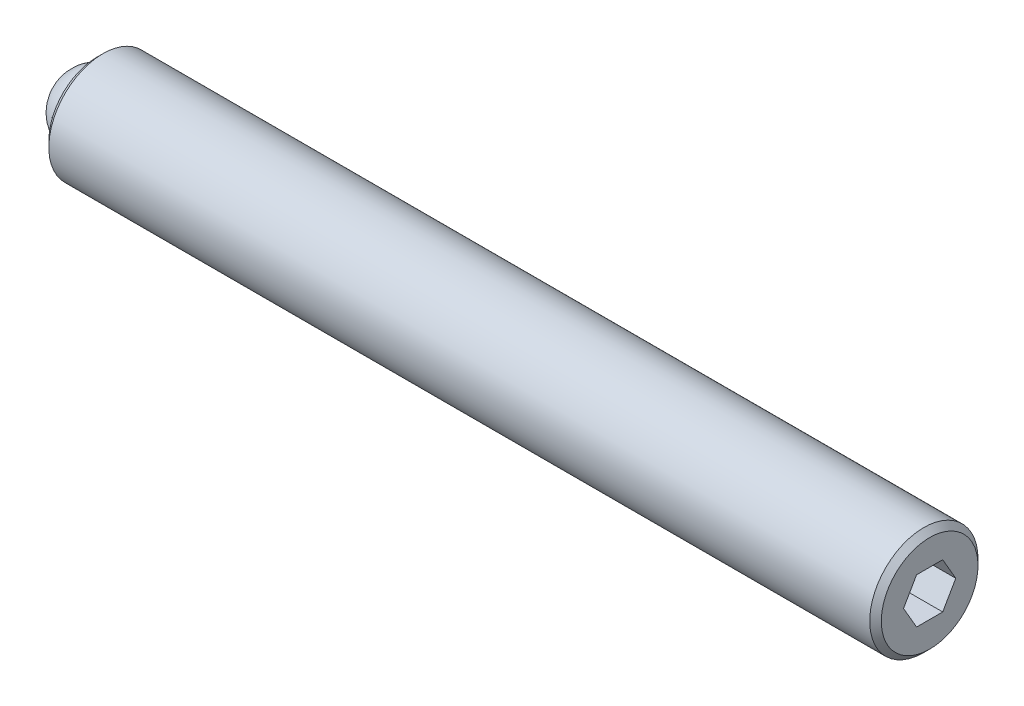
SolidWorks part; units mm, degrees
ref_plane "Front Plane" through (0, 0, 0) normal (0, 0, 1) x (1, 0, 0)
ref_plane "Top Plane" through (0, 0, 0) normal (0, 1, 0) x (1, 0, 0)
ref_plane "Right Plane" through (0, 0, 0) normal (1, 0, 0) x (0, 0, -1)
sketch "Sketch2" plane through (0, 0, 0) normal (1, 0, 0) x (0, 0, -1)
  circle A0 centre (0, 0) radius 2.3749
  dimension "D1" = 4.7498
extrude "Boss-Extrude1" add sketch "Sketch2" along normal blind 36.5125
sketch "Sketch3" plane through (0, 0, 0) normal (-1, 0, 0) x (0, 0, 1)
  circle A0 centre (0, 0) radius 1.5875
  dimension "D1" = 3.175
chamfer "Chamfer1" distance 0.254 angle 45 1 edges at (0, 0, -2.3749)
chamfer "Chamfer2" distance 0.254 angle 45 1 edges at (36.5125, 0, -2.3749)
sketch "Sketch4" plane through (36.5125, 0, 0) normal (1, 0, 0) x (0, 0, -1)
  line L1 (1.1457, 0) -> (0.5728, 0.9922)
  line L2 (0.5728, 0.9922) -> (-0.5728, 0.9922)
  line L3 (-0.5728, 0.9922) -> (-1.1457, 0)
  line L4 (-1.1457, 0) -> (-0.5728, -0.9922)
  line L5 (-0.5728, -0.9922) -> (0.5728, -0.9922)
  line L6 (0.5728, -0.9922) -> (1.1457, 0)
  circle A0 centre (0, 0) radius 0.9922 construction
extrude "Cut-Extrude2" cut sketch "Sketch4" against normal blind 2.286
extrude "Cut-Extrude3" cut sketch "Sketch3" against normal blind 1.5875
sketch "Sketch5" plane through (0, 0, 0) normal (-1, 0, 0) x (0, 0, 1)
  line L0 (0, 0) -> (0, -1.5875)
  line L1 (0, 0) -> (0, 1.5875)
  arc A0 (0, 1.5875) -> (0, -1.5875) centre (0, 0) ccw
revolve "Revolve1" add sketch "Sketch5" angle 360 about L1
sketch "Sketch6" plane through (0, 0, 0) normal (-1, 0, 0) x (0, 0, 1)
  line L0 (0, 0) -> (0, 1.5875) construction
  arc A0 (0.0635, 1.5862) -> (-0.0635, 1.5862) centre (0, 0) ccw
  circle A1 centre (0, 0) radius 1.5875 construction
  circle A3 centre (0, 0) radius 1.5875 construction
  arc A4 (0.0635, 1.5862) -> (-0.0635, 1.5862) centre (0, 1.5875) ccw
  dimension "D1" = 0.127
extrude "Cut-Extrude6" cut sketch "Sketch6" against normal blind 1.5875
